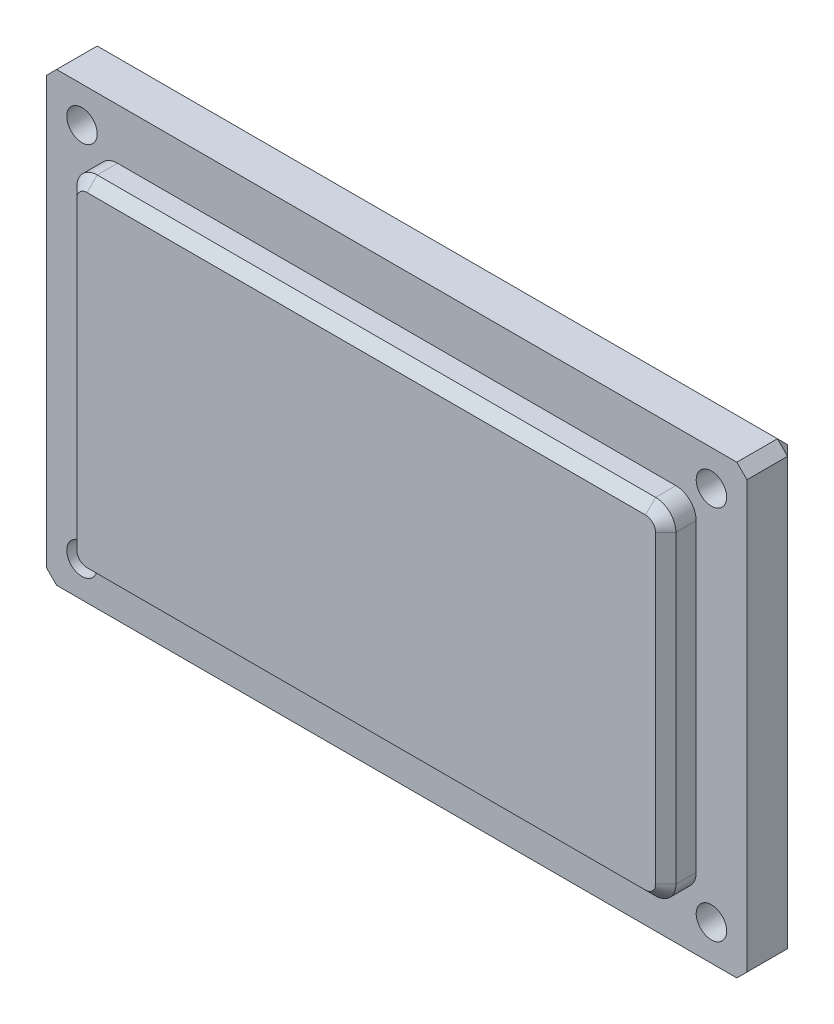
SolidWorks part; units mm, degrees
ref_plane "Přední rovina" through (0, 0, 0) normal (0, 0, 1) x (1, 0, 0)
ref_plane "Horní rovina" through (0, 0, 0) normal (0, 1, 0) x (1, 0, 0)
ref_plane "Pravá rovina" through (0, 0, 0) normal (1, 0, 0) x (0, 0, -1)
sketch "Skica1" plane through (0, 0, 0) normal (0, 0, 1) x (1, 0, 0)
  line L0 (0, 0) -> (69, 0) construction
  line L1 (-34.5, 22) -> (34.5, 22)
  line L2 (0, 44) -> (0, 0) construction
  line L3 (34.5, 22) -> (34.5, -22)
  line L4 (-34.5, -22) -> (34.5, -22)
  line L5 (-34.5, 22) -> (-34.5, -22)
  point P3 (-34.5, 0)
  point P8 (34.5, 0)
  point P10 (0, -22)
  point P11 (0, 22)
  dimension "D1" = 69
  dimension "D2" = 44
extrude "Přidat vysunutím1" add sketch "Skica1" along normal blind 8
sketch "Skica2" plane through (0, 0, 8) normal (0, 0, 1) x (1, 0, 0)
  line L0 (0, 22) -> (0, 0) construction
  line L1 (34.5, 22) -> (-34.5, 22) construction
  line L2 (0, 0) -> (34.5, 0) construction
  line L3 (34.5, -22) -> (34.5, 22) construction
  line L12 (-34.5, 22) -> (34.5, 22)
  line L13 (34.5, 22) -> (34.5, -22)
  line L14 (34.5, -22) -> (-34.5, -22)
  line L15 (-34.5, -22) -> (-34.5, 22)
  line L17 (-29.5, 17) -> (29.5, 17)
  line L18 (-29.5, 17) -> (-29.5, -17)
  line L19 (-29.5, -17) -> (29.5, -17)
  line L20 (29.5, 17) -> (29.5, -17)
  dimension "D1" = 5
  dimension "D2" = 59
  dimension "D3" = 5
  dimension "D4" = 34
extrude "Odebrat vysunutím1" cut sketch "Skica2" against normal blind 3
sketch "Skica3" plane through (0, 0, 5) normal (0, 0, 1) x (1, 0, 0)
  line L0 (0, 22) -> (0, 0) construction
  line L1 (34.5, 22) -> (-34.5, 22) construction
  line L2 (0, 0) -> (34.5, 0) construction
  line L3 (34.5, -22) -> (34.5, 22) construction
  circle A0 centre (-31, 18.5) radius 1.5
  circle A1 centre (-31, -18.5) radius 1.5
  circle A2 centre (31, 18.5) radius 1.5
  circle A3 centre (31, -18.5) radius 1.5
  dimension "D1" = 3
  dimension "D2" = 18.5
  dimension "D3" = 31
extrude "Odebrat vysunutím2" cut sketch "Skica3" against normal blind 5
fillet "Zaoblit1" radius 2 4 edges at (-29.5, -17, 6.5) (-29.5, 17, 6.5) (29.5, 17, 6.5) (29.5, -17, 6.5)
chamfer "Zkosení2" distance 1 angle 45 16 edges at (34.5, 0, 0) (34.5, -22, 2.5) (0, -22, 0) (34.5, 22, 2.5) (0, 22, 0) (-34.5, 22, 2.5) (-34.5, 0, 0) (-34.5, -22, 2.5) (29.5, 0, 8) (0, -17, 8) (-29.5, 0, 8) (0, 17, 8) (-28.9142, 16.4142, 8) (28.9142, 16.4142, 8) (28.9142, -16.4142, 8) (-28.9142, -16.4142, 8)
